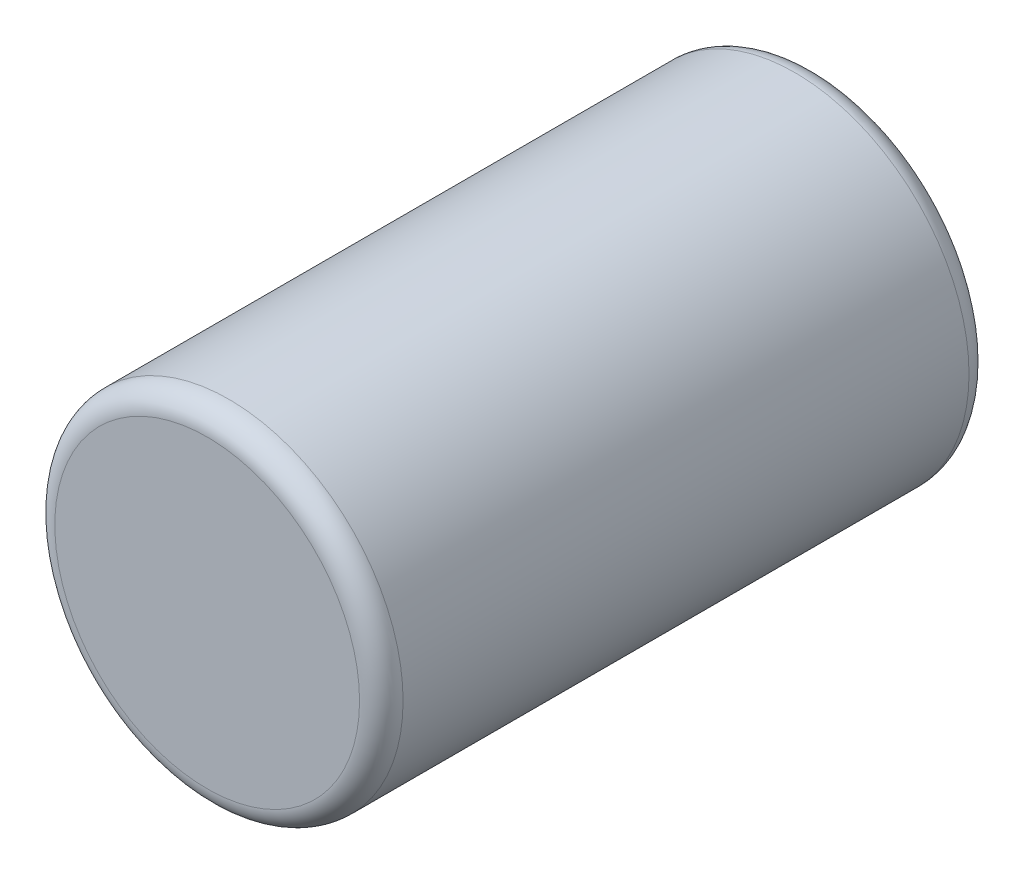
SolidWorks part; units mm, degrees
ref_plane "Face" through (0, 0, 0) normal (0, 0, 1) x (1, 0, 0)
ref_plane "Dessus" through (0, 0, 0) normal (0, 1, 0) x (1, 0, 0)
ref_plane "Droite" through (0, 0, 0) normal (1, 0, 0) x (0, 0, -1)
sketch "Esquisse1" plane through (0, 0, 0) normal (0, 0, 1) x (1, 0, 0)
  circle A0 centre (0, 0) radius 40
  dimension "D1" = 80
extrude "Base-Extrusion" add sketch "Esquisse1" along normal blind 140
fillet "Congé1" radius 5
